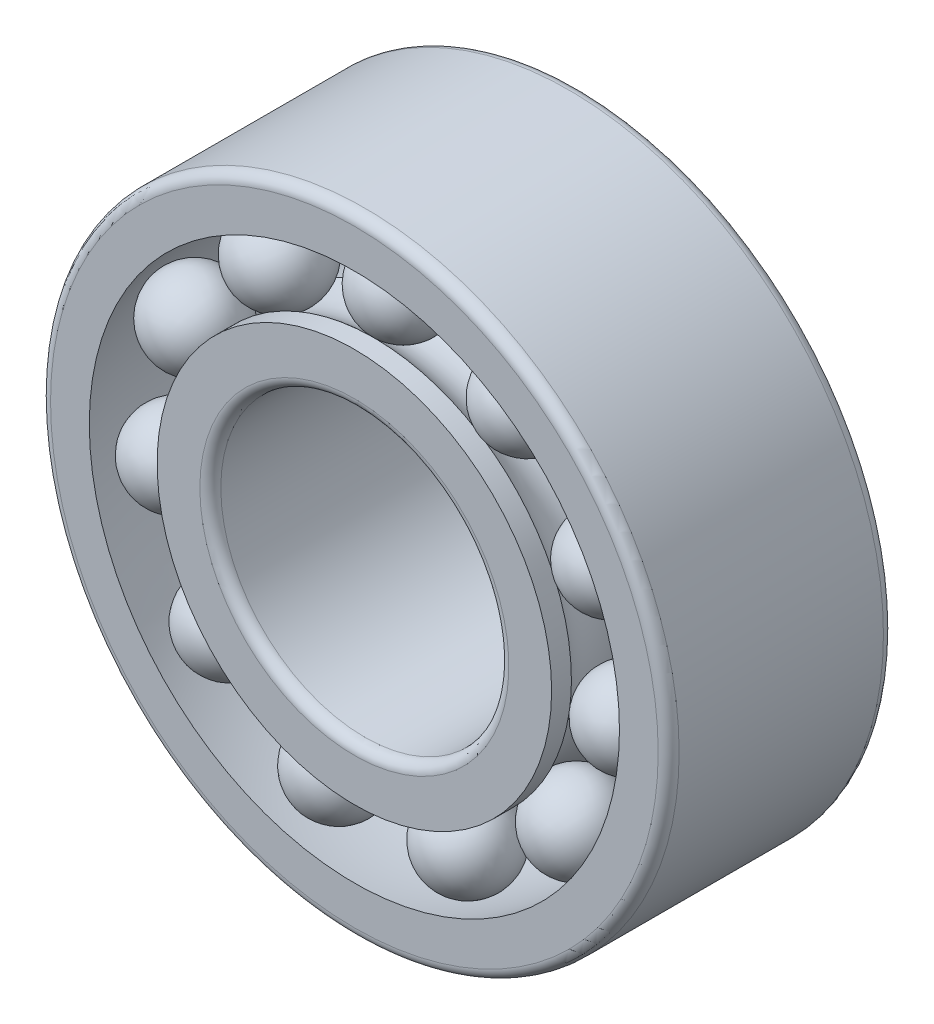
SolidWorks part; units mm, degrees
ref_plane "Front Plane" through (0, 0, 0) normal (0, 0, 1) x (1, 0, 0)
ref_plane "Top Plane" through (0, 0, 0) normal (0, 1, 0) x (1, 0, 0)
ref_plane "Right Plane" through (0, 0, 0) normal (1, 0, 0) x (0, 0, -1)
sketch "BaseSke" plane through (0, 0, 0) normal (1, 0, 0) x (0, 0, -1)
  line L0 (-47.2296, 0) -> (24.6132, 0) construction
  line L1 (-47.2296, 43.75) -> (24.6132, 43.75) construction
  line L2 (0, 129.5214) -> (0, -86.3012) construction
  line L3 (-12.1558, 52.0192) -> (-12.1558, 35.4808)
  line L4 (-21.5, 60) -> (21.5, 60) construction
  line L5 (-21.5, 27.5) -> (21.5, 27.5) construction
  line L6 (-21.5, 60) -> (-21.5, 27.5) construction
  line L7 (21.5, 60) -> (21.5, 27.5) construction
  line L8 (-20.425, 60) -> (-20.425, 27.5) construction
  arc A0 (-12.1558, 52.0192) -> (-12.1558, 35.4808) centre (-12.1558, 43.75) ccw
revolve "Ball" add sketch "BaseSke" angle 360 about L3
sketch "OuterRaceSke" plane through (0, 0, 0) normal (1, 0, 0) x (0, 0, -1)
  line L0 (0, 0) -> (0, 87.5396) construction
  line L1 (-21.5, 60) -> (21.5, 60)
  line L2 (-21.5, 60) -> (-21.5, 50.6063)
  line L4 (21.5, 60) -> (21.5, 50.6063)
  line L5 (-50.3916, 0) -> (55.2197, 0) construction
  arc A0 (-21.5, 50.6063) -> (21.5, 50.6063) centre (0, -57.2721) cw
  arc A1 (-21.5, 50.6267) -> (21.5, 50.6267) centre (0, -57.2721) cw construction
  arc A2 (-12.1558, 52.0192) -> (-12.1558, 35.4808) centre (-12.1558, 43.75) ccw construction
revolve "OuterRace" add sketch "OuterRaceSke" angle 360 about L5
mirror "MirrorBall" about plane through (0, 0, 0) normal (0, 0, 1) of "Ball"
sketch "InnerRaceSke" plane through (0, 0, 0) normal (1, 0, 0) x (0, 0, -1)
  line L0 (-70.8626, 0) -> (113.5527, 0) construction
  line L1 (0, 58.441) -> (0, -70.8113) construction
  line L2 (-21.5, 27.5) -> (21.5, 27.5)
  line L3 (-21.5, 27.5) -> (-21.5, 37.6562)
  line L4 (-21.5, 37.6562) -> (-17.7308, 37.6562)
  line L5 (21.5, 27.5) -> (21.5, 37.6563)
  line L6 (0, 129.5214) -> (0, -86.3012) construction
  line L7 (-6.5807, 37.6562) -> (6.5807, 37.6562)
  line L8 (21.5, 37.6563) -> (17.7308, 37.6562)
  arc A0 (-17.7308, 37.6562) -> (-6.5807, 37.6562) centre (-12.1558, 43.75) ccw
  circle A1 centre (-12.1558, 43.75) radius 8.2692 construction
  arc A2 (17.7308, 37.6562) -> (6.5807, 37.6562) centre (12.1558, 43.75) cw
  point P17 (0, 27.5)
  point P23 (0, 37.6562)
revolve "InnerRace" add sketch "InnerRaceSke" angle 360 about L0
fillet "Fillet1" radius 2 4 edges at (27.5, 0, -21.5) (27.5, 0, 21.5) (60, 0, -21.5) (60, 0, 21.5)
pattern_circular "CirPatternBall" count 11 over 360 about axis through (0, 0, 0) along (0, 0, 1) of "Ball", "MirrorBall"
sketch "TaperSke" plane through (0, 0, 0) normal (1, 0, 0) x (0, 0, -1)
  line L0 (-21.5, 27.5) -> (21.5, 27.5)
  line L1 (21.5, 27.5) -> (21.5, 31.0833)
  line L2 (21.5, 31.0833) -> (-21.5, 27.5)
  line L7 (-41.2502, 0) -> (40.8606, 0) construction
revolve "Taper" [suppressed] cut sketch "TaperSke" angle 360 about L7
fillet "Fillet2" [suppressed] radius 2
sketch "SimplifiedSke" plane through (0, 0, 0) normal (1, 0, 0) x (0, 0, -1)
  line L0 (37.5911, 0) -> (-37.5911, 0) construction
  line L1 (0, 0) -> (0, 72.9012) construction
  circle A0 centre (-12.1558, 43.75) radius 8.2692
  circle A1 centre (-12.1558, 43.75) radius 8.2692 construction
  circle A2 centre (12.1558, 43.75) radius 8.2692
revolve "Simplified" [suppressed] add sketch "SimplifiedSke" angle 360 about L0
equation "\"D1@BaseSke\" =  (\"Bearing_Outside_Diameter@BaseSke\"  +  \"Bearing_Inside_Diameter@BaseSke\"  )  / 4"
equation "\"Ball_diameter@BaseSke\" = \"Bearing_Thickness@BaseSke\" / 2.6"
equation "\"D2@BaseSke\" = \"Bearing_Thickness@BaseSke\"/40"
equation "\"D1@OuterRaceSke\" = \"Bearing_Inside_Diameter@BaseSke\"*2"
equation "\"D1@InnerRaceSke\" = \"Bearing_Inside_Diameter@BaseSke\" +  ( \"Bearing_Outside_Diameter@BaseSke\" - \"Bearing_Inside_Diameter@BaseSke\" )  / 3.2"
equation "\"D2@InnerRaceSke\" = \"Ball_diameter@BaseSke\"-0.02"
equation "\"D1@CirPatternBall\" = int( \"D1@BaseSke\"* pi  * 2 / \"Ball_diameter@BaseSke\" /1.4)"
equation "\"Taper@TaperSke\" = \"Bearing_Thickness@BaseSke\"/12"
equation "\"D1@Fillet2\" = \"Fillet_radius@Fillet1\""
